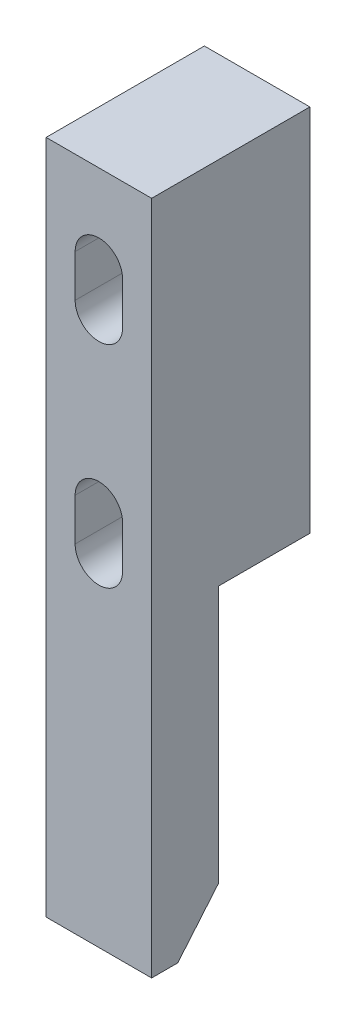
SolidWorks part; units mm, degrees
ref_plane "前视基准面" through (0, 0, 0) normal (0, 0, 1) x (1, 0, 0)
ref_plane "上视基准面" through (0, 0, 0) normal (0, 1, 0) x (1, 0, 0)
ref_plane "右视基准面" through (0, 0, 0) normal (1, 0, 0) x (0, 0, -1)
sketch "草图2" plane through (0, 0, 0) normal (0, 0, 1) x (1, 0, 0)
  line L0 (0, 0) -> (0, 64)
  line L1 (10, 0) -> (10, 64)
  line L2 (0, 64) -> (10, 64)
  line L3 (0, 0) -> (10, 0)
  line L4 (7.25, 32) -> (7.25, 36)
  line L5 (2.75, 36) -> (2.75, 32)
  line L6 (7.25, 52) -> (7.25, 56)
  line L7 (2.75, 56) -> (2.75, 52)
  arc A0 (7.25, 36) -> (2.75, 36) centre (5, 36) ccw
  arc A1 (2.75, 32) -> (7.25, 32) centre (5, 32) ccw
  arc A2 (7.25, 56) -> (2.75, 56) centre (5, 56) ccw
  arc A3 (2.75, 52) -> (7.25, 52) centre (5, 52) ccw
extrude "凸台-拉伸1" add sketch "草图2" along normal blind 15
sketch "草图3" plane through (10, 0, 0) normal (1, 0, 0) x (0, 0, -1)
  line L0 (-8.65, 4.6165) -> (-8.65, 29)
  line L1 (-12.5237, 0) -> (-8.65, 4.6165)
  line L2 (-15, 0) -> (-15, 64)
  line L3 (-15, 64) -> (0, 64)
  line L4 (-15, 0) -> (-12.5237, 0)
  line L5 (0, 29) -> (0, 64)
  line L6 (-8.65, 29) -> (0, 29)
extrude "切除-拉伸1" cut sketch "草图3" against normal blind 15 flip side to cut
